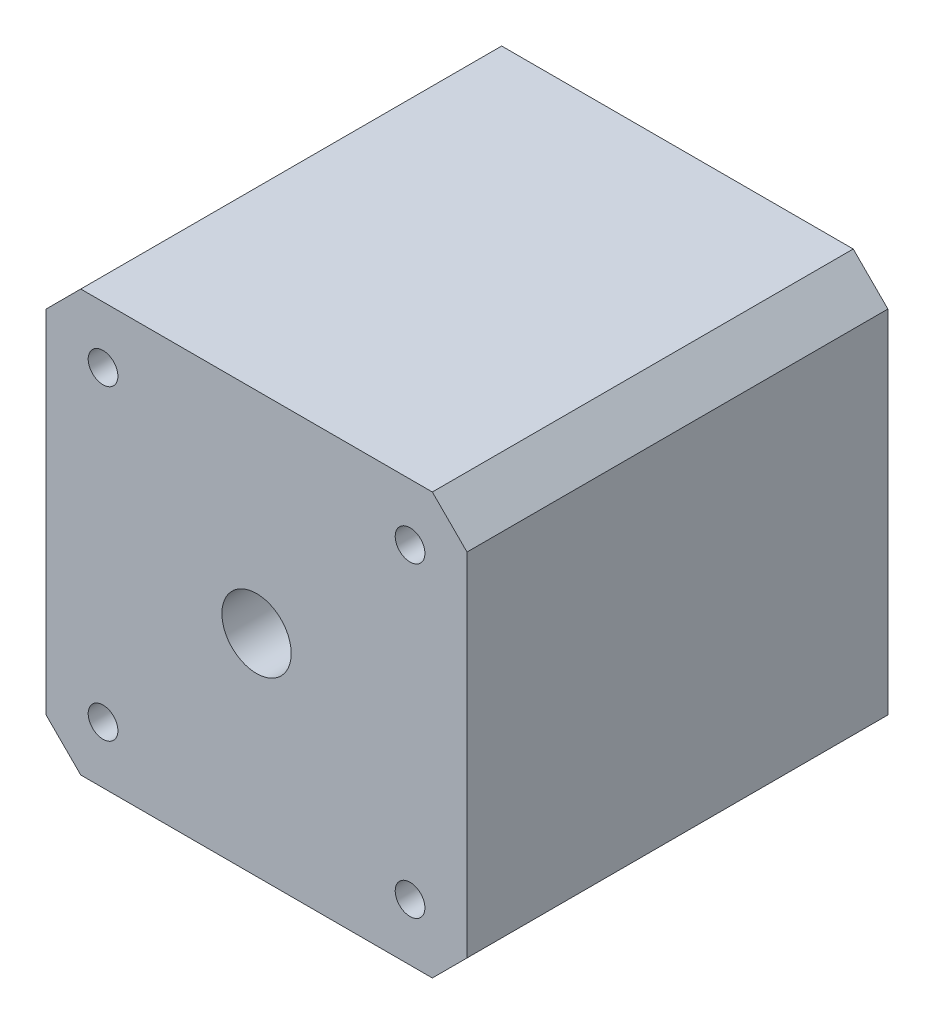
SolidWorks part; units mm, degrees
ref_plane "前视" through (0, 0, 0) normal (0, 0, 1) x (1, 0, 0)
ref_plane "上视" through (0, 0, 0) normal (0, 1, 0) x (1, 0, 0)
ref_plane "右视" through (0, 0, 0) normal (1, 0, 0) x (0, 0, -1)
sketch "草图1" plane through (0, 0, 0) normal (0, 0, 1) x (1, 0, 0)
  line L0 (-21.25, 17.75) -> (-17.75, 21.25)
  line L1 (17.75, -21.25) -> (-17.75, -21.25)
  line L2 (21.25, -17.75) -> (21.25, 17.75)
  line L3 (17.75, 21.25) -> (-17.75, 21.25)
  line L4 (-21.25, -17.75) -> (-21.25, 17.75)
  line L5 (21.4505, -21.4505) -> (-21.0495, 21.0495) construction
  line L6 (21.25, 21.25) -> (-21.25, -21.25) construction
  line L9 (21.25, 17.75) -> (17.75, 21.25)
  line L10 (21.25, -17.75) -> (17.75, -21.25)
  line L13 (-21.25, -17.75) -> (-17.75, -21.25)
  point P0 (0, 0)
  dimension "D1" = 42.3
  dimension "D2" = 42.3
extrude "凸台-拉伸1" add sketch "草图1" along normal blind 42.5
sketch "草图2" plane through (0, 0, 0) normal (0, 0, -1) x (-1, 0, 0)
  circle A0 centre (0, 0) radius 3.5
extrude "切除-拉伸1" cut sketch "草图2" against normal blind 42.5
sketch "草图3" plane through (0, 0, 0) normal (0, 0, -1) x (-1, 0, 0)
  line L1 (15.5, -15.5) -> (-15.5, -15.5)
  line L2 (15.5, -15.5) -> (15.5, 15.5)
  line L5 (15.5, -15.5) -> (-15.5, 15.5) construction
  line L6 (15.5, 15.5) -> (-15.5, -15.5) construction
  circle A0 centre (-15.5, 15.5) radius 1.5
  circle A1 centre (15.5, 15.5) radius 1.5
  circle A2 centre (-15.5, -15.5) radius 1.5
  circle A3 centre (15.5, -15.5) radius 1.5
  point P0 (0, 0)
  dimension "D1" = 31
  dimension "D2" = 31
extrude "切除-拉伸2" cut sketch "草图3" against normal blind 42.5 contours A0 | A2
pattern_circular "阵列(圆周)1" count 4 over 360 about axis through (0, 0, 0) along (0, 0, 1) of "切除-拉伸2"
